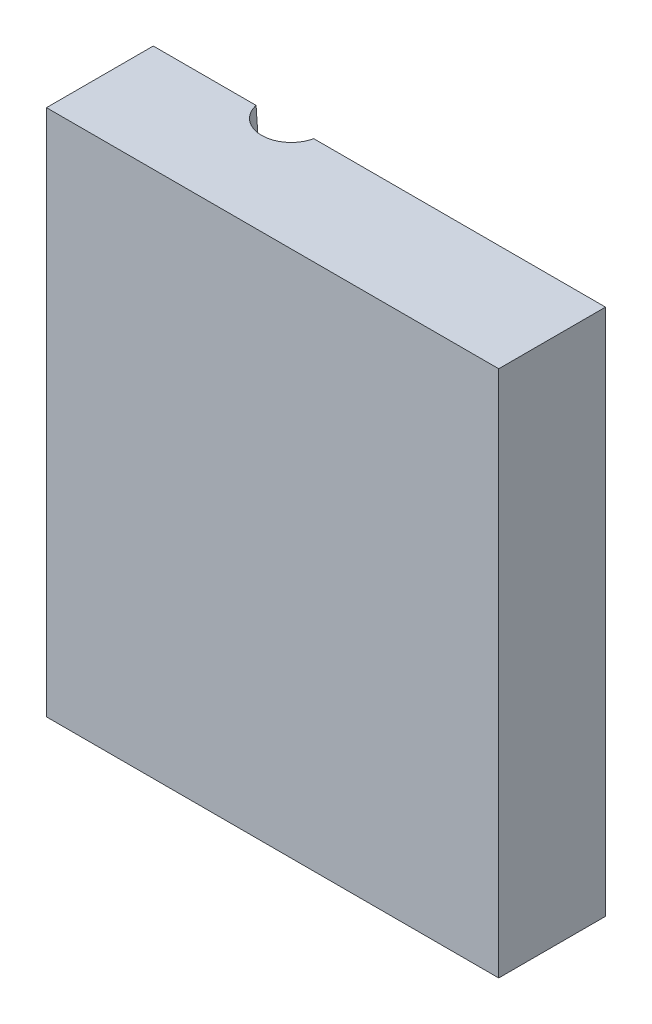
SolidWorks part; units mm, degrees
ref_plane "Front Plane" through (0, 0, 0) normal (0, 0, 1) x (1, 0, 0)
ref_plane "Top Plane" through (0, 0, 0) normal (0, 1, 0) x (1, 0, 0)
ref_plane "Right Plane" through (0, 0, 0) normal (1, 0, 0) x (0, 0, -1)
sketch "Sketch1" plane through (0, 0, 0) normal (0, 0, 1) x (1, 0, 0)
  line L1 (0, 0) -> (250, 0)
  line L2 (0, 0) -> (0, 300)
  line L3 (0, 300) -> (250, 300)
  line L4 (250, 0) -> (250, 300)
  dimension "D1" = 250
  dimension "D2" = 300
sketch "Sketch2" plane through (0, 0, 0) normal (0, 0, 1) x (1, 0, 0)
  line L0 (0, 280) -> (0, 20)
  line L1 (20, 0) -> (230, 0)
  line L2 (250, 20) -> (250, 280)
  line L3 (230, 300) -> (70, 300)
  line L4 (35, 300) -> (35, 320)
  line L5 (35, 320) -> (70, 320)
  line L6 (70, 320) -> (70, 300)
  line L8 (215, 67.5) -> (200, 67.5)
  line L9 (200, 67.5) -> (155, 112.5)
  line L10 (155, 112.5) -> (155, 187.5)
  line L11 (155, 187.5) -> (200, 232.5)
  line L12 (200, 232.5) -> (215, 232.5)
  line L13 (215, 150) -> (155, 150) construction
  line L14 (215, 232.5) -> (215, 67.5)
  line L15 (35, 300) -> (20, 300)
  arc A0 (0, 20) -> (20, 0) centre (20, 20) ccw
  arc A1 (230, 0) -> (250, 20) centre (230, 20) ccw
  arc A2 (250, 280) -> (230, 300) centre (230, 280) ccw
  arc A3 (0, 280) -> (20, 300) centre (20, 280) cw
  point P10 (0, 0)
  point P13 (250, 0)
  point P16 (250, 300)
  point P19 (0, 300)
  point P34 (250, 150)
  dimension "D1" = 20
  dimension "D2" = 35
  dimension "D3" = 165
  dimension "D4" = 15
  dimension "D5" = 60
  dimension "D6" = 35
  dimension "D7" = 20
  dimension "D8" = 15
sketch "Sketch3" plane through (0, 0, 0) normal (0, 0, 1) x (1, 0, 0)
  line L0 (230, 300) -> (70, 300) construction
  line L4 (35, 300) -> (20, 300) construction
  line L5 (0, 280) -> (0, 20) construction
  line L6 (20, 0) -> (230, 0) construction
  line L7 (250, 20) -> (250, 280) construction
  line L8 (230, 300) -> (70, 300)
  line L12 (70, 300) -> (20, 300)
  line L13 (0, 280) -> (0, 20)
  line L14 (20, 0) -> (230, 0)
  line L15 (250, 20) -> (250, 280)
  arc A0 (20, 300) -> (0, 280) centre (20, 280) ccw construction
  arc A1 (0, 20) -> (20, 0) centre (20, 20) ccw construction
  arc A2 (230, 0) -> (250, 20) centre (230, 20) ccw construction
  arc A3 (250, 280) -> (230, 300) centre (230, 280) ccw construction
  arc A4 (20, 300) -> (0, 280) centre (20, 280) ccw
  arc A5 (0, 20) -> (20, 0) centre (20, 20) ccw
  arc A6 (230, 0) -> (250, 20) centre (230, 20) ccw
  arc A7 (250, 280) -> (230, 300) centre (230, 280) ccw
extrude "Boss-Extrude1" add sketch "Sketch3" along normal blind 50 draft 2
sketch "Sketch4" plane through (0, 0, 50) normal (0, 0, 1) x (1, 0, 0)
  line L0 (215, 232.5) -> (215, 67.5) construction
  line L1 (215, 67.5) -> (200, 67.5) construction
  line L2 (200, 67.5) -> (155, 112.5) construction
  line L3 (155, 112.5) -> (155, 187.5) construction
  line L4 (155, 187.5) -> (200, 232.5) construction
  line L5 (200, 232.5) -> (215, 232.5) construction
  line L6 (215, 232.5) -> (215, 67.5)
  line L7 (215, 67.5) -> (200, 67.5)
  line L8 (200, 67.5) -> (155, 112.5)
  line L9 (155, 112.5) -> (155, 187.5)
  line L10 (155, 187.5) -> (200, 232.5)
  line L11 (200, 232.5) -> (215, 232.5)
extrude "Cut-Extrude1" cut sketch "Sketch4" against normal blind 15 draft 10
sketch "Sketch5" plane through (0, 0, 50) normal (0, 0, 1) x (1, 0, 0)
  line L0 (37.5, 222.5) -> (37.5, 77.5) construction
  line L1 (45, 222.5) -> (45, 77.5)
  line L2 (30, 222.5) -> (30, 77.5)
  line L4 (37.5, 150) -> (142.9758, 150) construction
  line L5 (67.5, 222.5) -> (67.5, 77.5) construction
  line L6 (75, 222.5) -> (75, 77.5)
  line L7 (60, 222.5) -> (60, 77.5)
  line L8 (97.5, 222.5) -> (97.5, 77.5) construction
  line L9 (105, 222.5) -> (105, 77.5)
  line L10 (90, 222.5) -> (90, 77.5)
  arc A0 (45, 222.5) -> (30, 222.5) centre (37.5, 222.5) ccw
  arc A1 (30, 77.5) -> (45, 77.5) centre (37.5, 77.5) ccw
  arc A2 (75, 222.5) -> (60, 222.5) centre (67.5, 222.5) ccw
  arc A3 (60, 77.5) -> (75, 77.5) centre (67.5, 77.5) ccw
  arc A4 (105, 222.5) -> (90, 222.5) centre (97.5, 222.5) ccw
  arc A5 (90, 77.5) -> (105, 77.5) centre (97.5, 77.5) ccw
  point P2 (37.5, 150)
  point P15 (67.5, 150)
  point P22 (97.5, 150)
  dimension "D1" = 15
  dimension "D2" = 145
  dimension "D3" = 30
  dimension "D4" = 3
extrude "Cut-Extrude2" cut sketch "Sketch5" against normal blind 5 draft 10
fillet "Fillet1" radius 10 8 edges at (242.9075, 292.9075, 50) (248.254, 150, 50) (242.9075, 7.0925, 50) (125, 1.746, 50) (7.0925, 7.0925, 50) (1.746, 150, 50) (7.0925, 292.9075, 50) (125, 298.254, 50)
sketch "Sketch6" plane through (0, 0, 0) normal (0, 0, -1) x (-1, 0, 0)
  line L4 (-250, 280) -> (-250, 20)
  line L5 (-230, 0) -> (-20, 0)
  line L6 (0, 20) -> (0, 280)
  line L7 (-20, 300) -> (-230, 300)
  line L8 (-250, 280) -> (-250, 20)
  line L9 (-230, 0) -> (-20, 0)
  line L10 (0, 20) -> (0, 280)
  line L11 (-20, 300) -> (-230, 300)
  arc A4 (-230, 300) -> (-250, 280) centre (-230, 280) ccw
  arc A5 (-250, 20) -> (-230, 0) centre (-230, 20) ccw
  arc A6 (-20, 0) -> (0, 20) centre (-20, 20) ccw
  arc A7 (0, 280) -> (-20, 300) centre (-20, 280) ccw
  arc A8 (-230, 300) -> (-250, 280) centre (-230, 280) ccw
  arc A9 (-250, 20) -> (-230, 0) centre (-230, 20) ccw
  arc A10 (-20, 0) -> (0, 20) centre (-20, 20) ccw
  arc A11 (0, 280) -> (-20, 300) centre (-20, 280) ccw
  dimension "D1" = 0
extrude "Boss-Extrude2" add sketch "Sketch6" along normal blind 5
fillet "Fillet2" radius 5 18 edges at (155, 150, 50) (177.5, 90, 50) (177.5, 210, 50) (207.5, 67.5, 50) (207.5, 232.5, 50) (212.3551, 150, 35) (206.7253, 70.1449, 35) (179.3702, 91.8702, 35) (157.6449, 150, 35) (179.3702, 208.1298, 35) (206.7253, 229.8551, 35) (215, 150, 50) (200.5478, 231.1775, 42.5) (156.3225, 113.0478, 42.5) (200.5478, 68.8225, 42.5) (213.6775, 68.8225, 42.5) (213.6775, 231.1775, 42.5) (156.3225, 186.9522, 42.5)
fillet "Fillet3" radius 3 24 edges at (37.5, 70, 50) (30, 150, 50) (37.5, 230, 50) (67.5, 70, 50) (60, 150, 50) (67.5, 230, 50) (97.5, 70, 50) (90, 150, 50) (97.5, 230, 50) (45, 150, 50) (75, 150, 50) (97.5, 229.1184, 45) (90.8816, 150, 45) (97.5, 70.8816, 45) (67.5, 229.1184, 45) (60.8816, 150, 45) (67.5, 70.8816, 45) (37.5, 229.1184, 45) (30.8816, 150, 45) (37.5, 70.8816, 45) (44.1184, 150, 45) (74.1184, 150, 45) (105, 150, 50) (104.1184, 150, 45)
mirror "Mirror1" about plane through (230, 280, -5) normal (0, 0, -1)
sketch "Sketch7" plane through (0, 300, 0) normal (0, 1, 0) x (1, 0, 0)
  circle A0 centre (54.8055, 5) radius 20
  dimension "D1" = 40
  dimension "D2" = 5
  dimension "D3" = 54.8055
extrude "Boss-Extrude3" add sketch "Sketch7" along normal mid plane 40
fillet "Fillet4" radius 5 4 edges at (34.8055, 300, -5) (54.8055, 299.4762, 15) (74.8055, 300, -5) (54.8055, 299.4762, -25)
shell "Shell1" thickness 4
sketch "Sketch10" plane through (0, 320, 0) normal (0, 1, 0) x (1, 0, 0)
  circle A1 centre (54.8055, 5) radius 20
  circle A3 centre (54.8055, 5) radius 20
  dimension "D1" = 0
extrude "Boss-Extrude6" add sketch "Sketch10" along normal blind 80 draft 4
sketch "Sketch8" plane through (0, 0, 0) normal (0, 0, 1) x (1, 0, 0)
  line L1 (-50, -50) -> (310, -50)
  line L2 (-50, -50) -> (-50, 370)
  line L3 (-50, 370) -> (310, 370)
  line L4 (310, -50) -> (310, 370)
  dimension "D1" = 50
  dimension "D2" = 50
  dimension "D3" = 360
  dimension "D4" = 420
extrude "Boss-Extrude4" add sketch "Sketch8" along normal blind 85 separate body
sketch "Sketch9" plane through (0, 0, 0) normal (0, 0, 1) x (1, 0, 0)
  line L1 (-31.5724, 338.5114) -> (-15.0677, 338.5114)
  line L2 (-31.5724, 338.5114) -> (-31.5724, 315.0573)
  line L3 (-31.5724, 315.0573) -> (-15.0677, 315.0573)
  line L4 (-15.0677, 338.5114) -> (-15.0677, 315.0573)
  line L5 (263.775, 338.5114) -> (289.835, 338.5114)
  line L6 (263.775, 338.5114) -> (263.775, 315.0573)
  line L7 (263.775, 315.0573) -> (289.835, 315.0573)
  line L8 (289.835, 338.5114) -> (289.835, 315.0573)
  line L9 (263.775, -20.2487) -> (289.835, -20.2487)
  line L10 (263.775, -20.2487) -> (263.775, -39.3594)
  line L11 (263.775, -39.3594) -> (289.835, -39.3594)
  line L12 (289.835, -20.2487) -> (289.835, -39.3594)
  line L13 (0, -29.8041) -> (-36.7844, -29.8041)
  line L14 (0, -29.8041) -> (0, -20.2487)
  line L15 (0, -20.2487) -> (-36.7844, -20.2487)
  line L16 (-36.7844, -29.8041) -> (-36.7844, -20.2487)
extrude "Cut-Extrude3" cut sketch "Sketch9" along normal blind 30 draft 0.5
combine bodies "Combine3" operation type subtract main body 112 bodies to subtract 110
